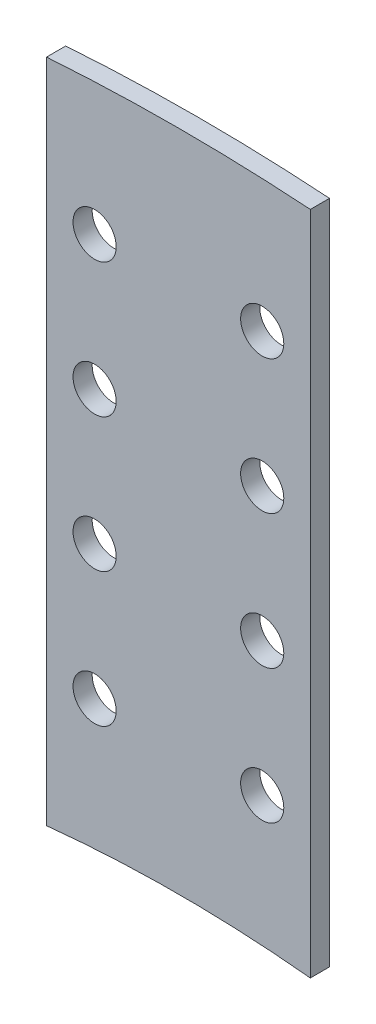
SolidWorks part; units mm, degrees
ref_plane "Plan de face" through (0, 0, 0) normal (0, 0, 1) x (1, 0, 0)
ref_plane "Plan de dessus" through (0, 0, 0) normal (0, 1, 0) x (1, 0, 0)
ref_plane "Plan de droite" through (0, 0, 0) normal (1, 0, 0) x (0, 0, -1)
sketch "Esquisse1" plane through (0, 0, 0) normal (0, 0, 1) x (1, 0, 0)
  line L1 (-55, -139.715) -> (55, -139.715)
  line L2 (-55, -139.715) -> (-55, 139.715)
  line L3 (-55, 139.715) -> (55, 139.715)
  line L4 (55, -139.715) -> (55, 139.715)
  line L5 (-55, -139.715) -> (55, 139.715) construction
  line L6 (-55, 139.715) -> (55, -139.715) construction
  point P0 (0, 0)
  dimension "D1" = 139.715
  dimension "D2" = 55
extrude "Boss.-Extru.1" add sketch "Esquisse1" along normal blind 8
sketch "Esquisse2" plane through (0, 0, 8) normal (0, 0, 1) x (1, 0, 0)
  line L2 (-55, 139.715) -> (-55, -139.715) construction
  line L3 (55, 139.715) -> (-55, 139.715) construction
  circle A0 centre (-34.94, 83.835) radius 9
  circle A1 centre (34.94, 83.835) radius 9
  dimension "D1" = 18
  dimension "D2" = 18
  dimension "D3" = 69.88
  dimension "D4" = 20.06
  dimension "D5" = 55.88
extrude "Enlèv. mat.-Extru.1" cut sketch "Esquisse2" against normal through all
pattern_linear "Répétition linéaire3" count 4 spacing 55.88 along (0, -1, 0) of "Enlèv. mat.-Extru.1"
sketch "Esquisse3" plane through (0, 0, 8) normal (0, 0, 1) x (1, 0, 0)
  line L0 (55, 139.715) -> (-55, 139.715) construction
  line L1 (-55, 139.715) -> (-55, 137.8196) construction
  line L2 (-55, 139.715) -> (-55, -139.715) construction
  line L3 (55, 139.715) -> (55, 137.8196)
  line L4 (55, 139.715) -> (-55, 139.715)
  arc A0 (55, 137.8196) -> (-55, 137.8196) centre (0, -659.235) ccw
  dimension "D1" = 1597.9
extrude "Enlèv. mat.-Extru.2" cut sketch "Esquisse3" against normal through all contours A0 L4 M9 | A0 M7 M8
sketch "Esquisse4" plane through (0, 0, 8) normal (0, 0, 1) x (1, 0, 0)
  circle A0 centre (0, -676.9068) radius 540
  point P2 (0, -664.6197)
  point P3 (0, 0)
  dimension "D1" = 1080
extrude "Enlèv. mat.-Extru.3" cut sketch "Esquisse4" against normal through all
sketch "Esquisse5" plane through (0, 0, 8) normal (0, 0, 1) x (1, 0, 0)
  line L0 (0, -156.5873) -> (0, 180.8161) construction
